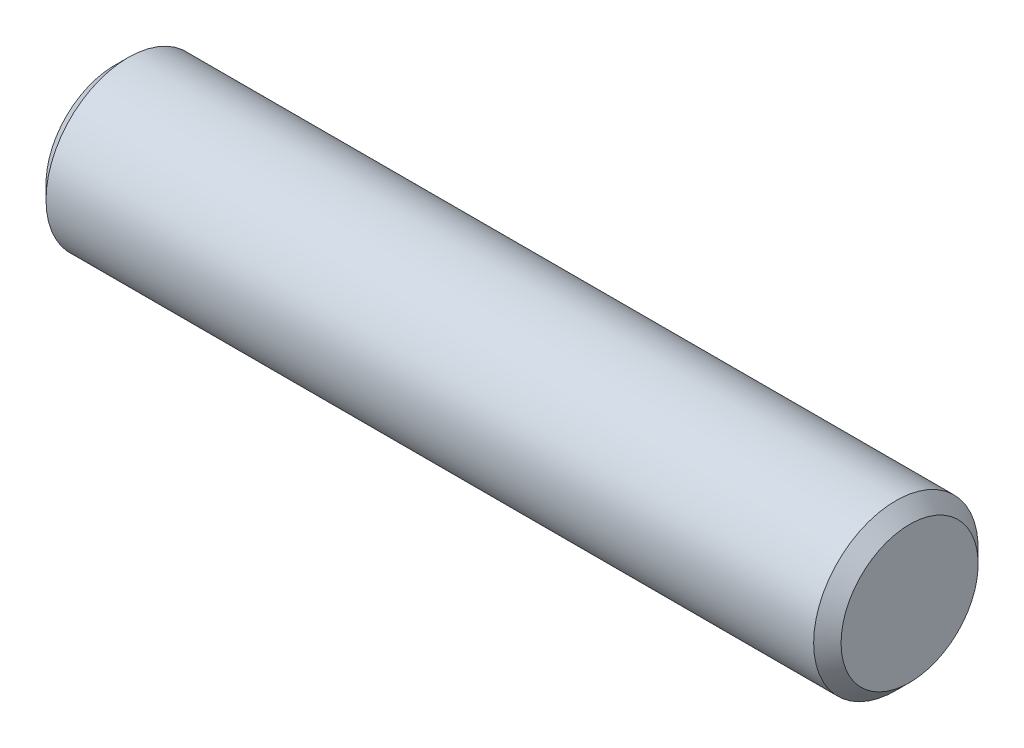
SolidWorks part; units mm, degrees
ref_plane "Face" through (0, 0, 0) normal (0, 0, 1) x (1, 0, 0)
ref_plane "Dessus" through (0, 0, 0) normal (0, 1, 0) x (1, 0, 0)
ref_plane "Droite" through (0, 0, 0) normal (1, 0, 0) x (0, 0, -1)
sketch "Esquisse1" plane through (0, 0, 0) normal (0, 0, 1) x (1, 0, 0)
  line L0 (-42.2506, 11.1534) -> (73.2533, 11.1534) construction
  line L1 (-20.3219, 11.1534) -> (-20.3219, 14.1534)
  line L2 (-20.3219, 14.1534) -> (8.6781, 14.1534)
  line L3 (8.6781, 14.1534) -> (8.6781, 11.1534)
  line L4 (-20.3219, 11.1534) -> (8.6781, 11.1534)
  dimension "D1" = 6
  dimension "D2" = 29
revolve "Révolution1" add sketch "Esquisse1" angle 360 about L0
chamfer "Chanfrein1" distance 0.5 angle 45 2 edges at (8.6781, 11.1534, 3) (-20.3219, 11.1534, 3)
